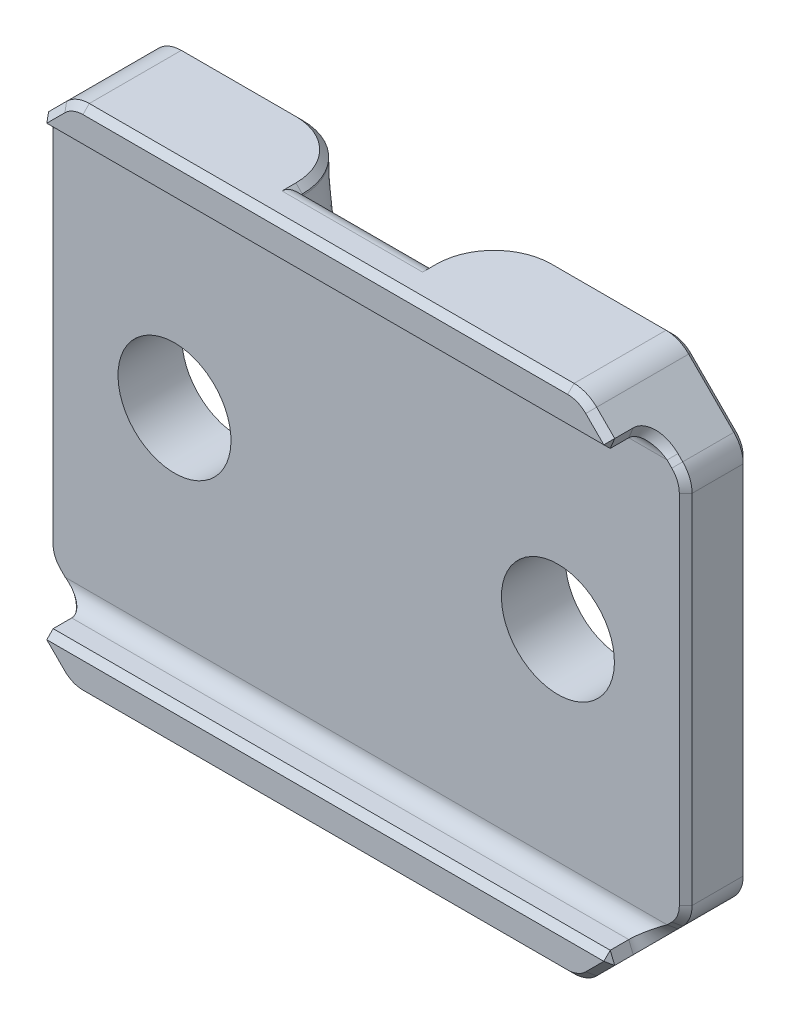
SolidWorks part; units mm, degrees
ref_plane "Front" through (0, 0, 0) normal (0, 0, 1) x (1, 0, 0)
ref_plane "Top" through (0, 0, 0) normal (0, 1, 0) x (1, 0, 0)
ref_plane "Right" through (0, 0, 0) normal (1, 0, 0) x (0, 0, -1)
sketch "Sketch1" plane through (0, 0, 0) normal (1, 0, 0) x (0, 0, -1)
  line L0 (0, 0) -> (0, 10.795)
  line L1 (0, 0) -> (0, -10.795)
  line L2 (-2.032, 12.7) -> (3.175, 12.7)
  line L3 (3.175, 12.7) -> (3.175, -12.7)
  line L4 (3.175, -12.7) -> (-2.032, -12.7)
  line L5 (-2.032, -12.7) -> (-27.432, -12.7) construction
  line L6 (-27.432, -12.7) -> (-27.432, 12.7) construction
  line L7 (-27.432, 12.7) -> (-2.032, 12.7) construction
  line L9 (-2.032, 12.7) -> (-2.032, 10.795)
  line L10 (-2.032, 10.795) -> (0, 10.795)
  line L12 (-2.032, -12.7) -> (-2.032, -10.795)
  line L13 (-2.032, -10.795) -> (0, -10.795)
  dimension "D1" = 25.4
  dimension "D2" = 3.175
  dimension "D3" = 21.59
  dimension "D4" = 2.032
extrude "Boss-Extrude1" add sketch "Sketch1" along normal mid plane 31.75
sketch "Sketch2" plane through (0, 0, -3.175) normal (0, 0, -1) x (-1, 0, 0)
  line L0 (-15.875, 0) -> (-9.525, 0) construction
  line L1 (-15.875, -12.7) -> (-15.875, 12.7) construction
  line L2 (-9.525, 0) -> (9.525, 0) construction
  line L3 (9.525, 0) -> (15.875, 0) construction
  line L4 (15.875, -12.7) -> (15.875, 12.7) construction
  dimension "D1" = 6.35
hole_wizard "#10 Clearance Hole1" positions "Sketch3" profile "Sketch4" hole size "#10" standard "ANSI Inch"
sketch "Sketch3" plane through (0, 0, -3.175) normal (0, 0, -1) x (-1, 0, 0)
  point P0 (-9.525, 0)
  point P3 (9.525, 0)
sketch "Sketch4" plane through (9.525, 0, -3.175) normal (1, 0, 0) x (0, 1, 0)
  line L0 (0, 0) -> (0, 5.207)
  line L1 (0, 5.207) -> (2.8067, 5.207)
  line L2 (2.8067, 5.207) -> (2.8067, 0)
  line L5 (2.8067, 0) -> (0, 0)
  line L11 (0, -6.35) -> (0, 107.95) construction
  dimension "Thru Hole Dia." = 5.6134
  dimension "Thru Hole Depth" = 5.207
sketch "Sketch5" plane through (0, 0, 0) normal (1, 0, 0) x (0, 0, -1)
  line L2 (3.175, -12.7) -> (3.175, 12.7) construction
  line L3 (-22.225, 0) -> (0, 0) construction
  line L4 (-0.228, 12.7) -> (3.175, 12.7)
  line L5 (3.175, 12.7) -> (-2.032, 12.7) construction
  line L6 (3.175, 12.7) -> (3.175, -12.7)
  line L7 (3.175, -12.7) -> (-0.228, -12.7)
  line L8 (-2.032, -12.7) -> (3.175, -12.7) construction
  arc A0 (-0.228, 12.7) -> (-0.228, -12.7) centre (-22.225, 0) cw
  dimension "D2" = 25.4
extrude "Cut-Extrude1" cut sketch "Sketch5" against normal mid plane 6.35 contours L4 A0 L6 | L6 A0 L7
fillet "Fillet1" radius 3.175 4 edges at (-3.175, 6.35, -3.175) (3.175, -6.35, -3.175) (-3.175, -6.35, -3.175) (3.175, 6.35, -3.175)
chamfer "Chamfer1" distance 3.175 angle 45 4 edges at (-15.875, -12.7, -0.5715) (-15.875, 12.7, -0.5715) (15.875, -12.7, -0.5715) (15.875, 12.7, -0.5715)
fillet "Fillet2" radius 1.5875 8 edges at (-15.875, 9.525, -1.5875) (-12.7, 12.7, -0.5715) (12.7, -12.7, -0.5715) (-12.7, -12.7, -0.5715) (-15.875, -9.525, -1.5875) (15.875, -9.525, -1.5875) (12.7, 12.7, -0.5715) (15.875, 9.525, -1.5875)
fillet "Fillet3" radius 0.7937 2 edges at (0, 12.7, 0.228) (0, -12.7, 0.228)
fillet "Fillet5" radius 0.7937 2 edges at (0, 10.795, 0) (0, -10.795, 0)
chamfer "Chamfer2" distance 0.3175 angle 45 26 edges at (-4.1049, -12.7, -2.2451) (-9.1962, -12.7, -3.175) (-12.6499, -12.5792, -3.175) (-14.2875, -11.1125, -3.175) (-15.7542, -9.4749, -3.175) (-15.875, 0, -3.175) (-15.7542, 9.4749, -3.175) (-14.2875, 11.1125, -3.175) (-12.6499, 12.5792, -3.175) (-9.1962, 12.7, -3.175) (-4.1049, 12.7, -2.2451) (4.1049, -12.7, -2.2451) (9.1962, -12.7, -3.175) (12.6499, -12.5792, -3.175) (14.2875, -11.1125, -3.175) (15.7542, -9.4749, -3.175) (15.875, 0, -3.175) (15.7542, 9.4749, -3.175) (14.2875, 11.1125, -3.175) (12.6499, 12.5792, -3.175) (9.1962, 12.7, -3.175) (4.1049, 12.7, -2.2451) (-3.175, -12.7, 0.3456) (-3.175, 12.7, 0.3456) (3.175, -12.7, 0.3456) (3.175, 12.7, 0.3456)
chamfer "Chamfer3" distance 0.3175 angle 45 30 edges at (15.4044, 9.9956, 0) (15.4044, -9.9956, 0) (15.7542, 9.4749, 0) (15.7542, -9.4749, 0) (15.875, 0, 0) (-15.4044, 9.9956, 0) (-15.4044, -9.9956, 0) (-15.7542, 9.4749, 0) (-15.7542, -9.4749, 0) (-15.875, 0, 0) (14.605, 10.795, 1.4129) (14.605, -10.795, 1.4129) (14.8375, 10.5625, 0.2325) (14.8375, -10.5625, 0.2325) (-14.605, 10.795, 1.4129) (-14.605, -10.795, 1.4129) (-14.8375, 10.5625, 0.2325) (-14.8375, -10.5625, 0.2325) (0, -10.795, 2.032) (0, 10.795, 2.032) (-13.885, 11.515, 2.032) (-12.6499, 12.5792, 2.032) (13.885, 11.515, 2.032) (0, 12.7, 2.032) (12.6499, 12.5792, 2.032) (-13.885, -11.515, 2.032) (-12.6499, -12.5792, 2.032) (0, -12.7, 2.032) (13.885, -11.515, 2.032) (12.6499, -12.5792, 2.032)
